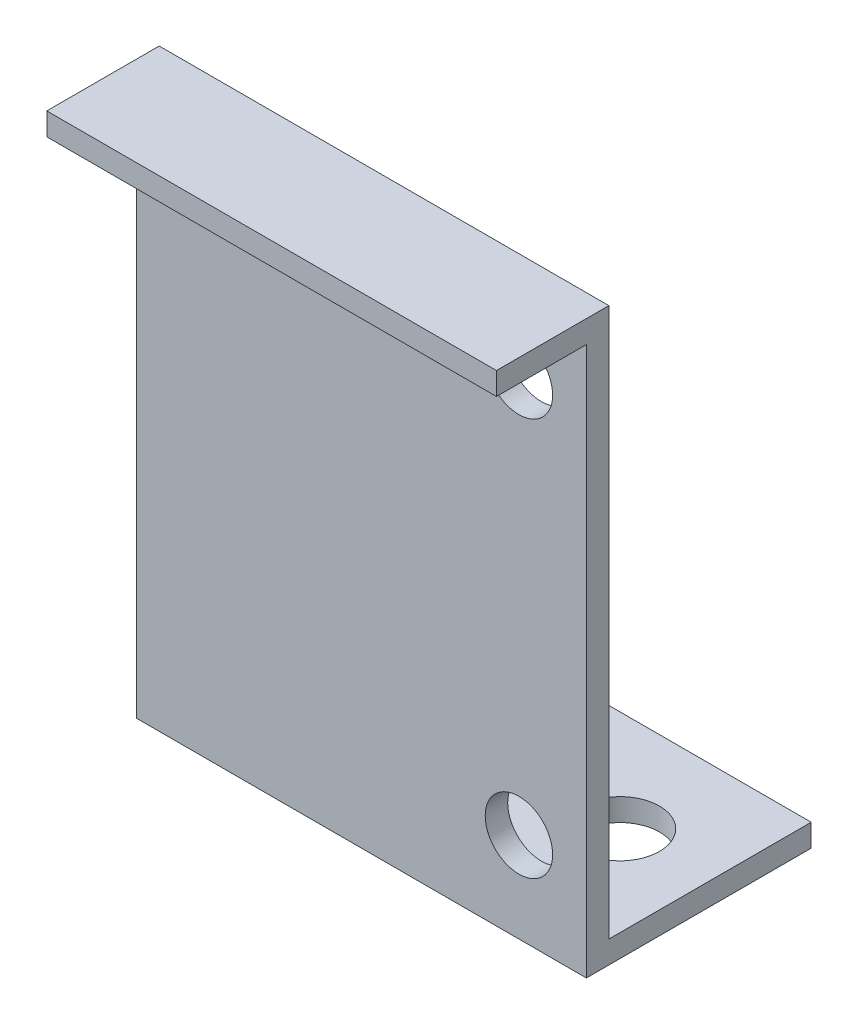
SolidWorks part; units mm, degrees
ref_plane "Front Plane" through (0, 0, 0) normal (0, 0, 1) x (1, 0, 0)
ref_plane "Top Plane" through (0, 0, 0) normal (0, 1, 0) x (1, 0, 0)
ref_plane "Right Plane" through (0, 0, 0) normal (1, 0, 0) x (0, 0, -1)
sketch "Sketch1" plane through (0, 0, 0) normal (1, 0, 0) x (0, 0, -1)
  line L0 (10, 0) -> (0, 0)
  line L1 (0, 0) -> (0, 24.4)
  line L2 (0, 24.4) -> (-4, 24.4)
  line L3 (10, 1) -> (1, 1)
  line L4 (1, 1) -> (1, 25.4)
  line L5 (1, 25.4) -> (-4, 25.4)
  line L6 (-4, 25.4) -> (-4, 24.4)
  line L7 (10, 1) -> (10, 0)
  dimension "D2" = 10
  dimension "D3" = 5
  dimension "D4" = 24.4
  dimension "D1" = 1
extrude "Extrude1" add sketch "Sketch1" along normal blind 20
sketch "Sketch2" plane through (0, 1, 0) normal (0, 1, 0) x (1, 0, 0)
  line L0 (20, 5.5) -> (0, 5.5) construction
  line L3 (10, 1) -> (10, 10) construction
  line L4 (20, 1) -> (0, 1) construction
  line L5 (20, 10) -> (0, 10) construction
  line L6 (20, 10) -> (20, 1) construction
  line L7 (0, 10) -> (0, 1) construction
  circle A0 centre (4, 5.5) radius 1.75
  circle A1 centre (16, 5.5) radius 1.75
  dimension "D1" = 12
  dimension "D2" = 3.5
  dimension "D3" = 6
extrude "Extrude2" cut sketch "Sketch2" against normal blind 20
sketch "Sketch3" plane through (0, 0, -1) normal (0, 0, -1) x (-1, 0, 0)
  line L0 (-17, 25.4) -> (-17, 1) construction
  line L3 (-20, 13.2) -> (0, 13.2) construction
  line L4 (-20, 1) -> (-20, 25.4) construction
  line L5 (0, 1) -> (0, 25.4) construction
  line L6 (-20, 25.4) -> (0, 25.4) construction
  line L7 (-20, 1) -> (0, 1) construction
  circle A0 centre (-17, 21.7) radius 1.5
  circle A1 centre (-17, 4) radius 1.5
  dimension "D1" = 17.7
  dimension "D2" = 3
  dimension "D3" = 3
  dimension "D4" = 9.2
  dimension "D5" = 3
extrude "Extrude3" cut sketch "Sketch3" against normal blind 20
